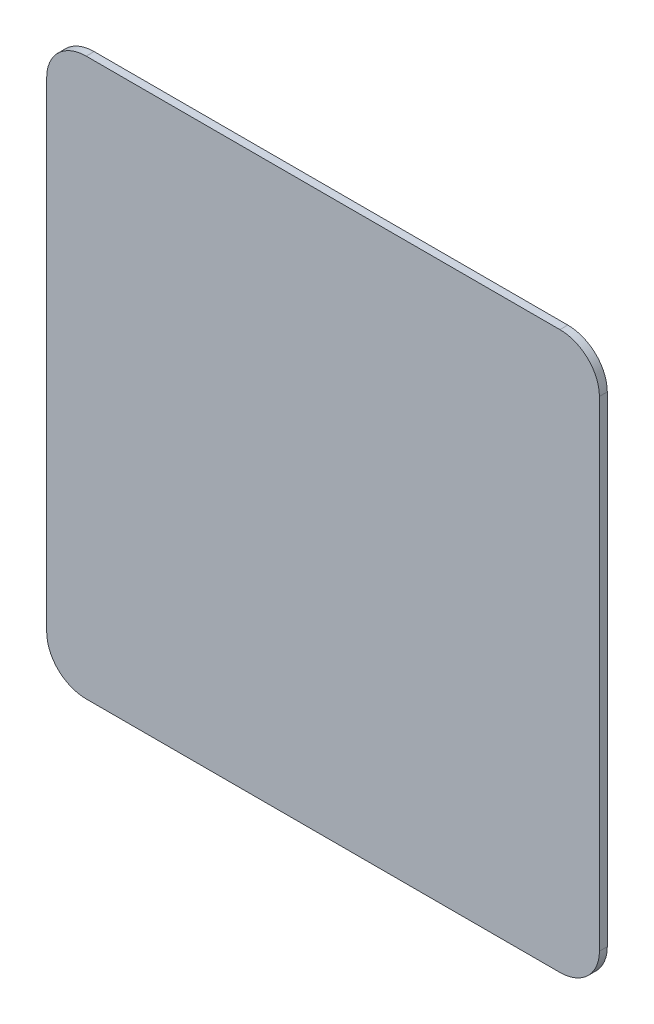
SolidWorks part; units mm, degrees
ref_plane "Front Plane" through (0, 0, 0) normal (0, 0, 1) x (1, 0, 0)
ref_plane "Top Plane" through (0, 0, 0) normal (0, 1, 0) x (1, 0, 0)
ref_plane "Right Plane" through (0, 0, 0) normal (1, 0, 0) x (0, 0, -1)
sketch "Sketch1" plane through (0, 0, 0) normal (0, 0, 1) x (1, 0, 0)
  line L0 (350, -287.1896) -> (350, 321.3437) construction
  line L1 (-300, -335.4858) -> (300, -335.4858) construction
  line L2 (300, 369.64) -> (-300, 369.64) construction
  line L3 (-350, 321.3437) -> (-350, -287.1896) construction
  line L4 (350, -287.1896) -> (350, 321.3437)
  line L5 (-300, -335.4858) -> (300, -335.4858)
  line L6 (300, 369.64) -> (-300, 369.64)
  line L7 (-350, 321.3437) -> (-350, -287.1896)
  ellipse E0 centre (300, 321.3437) end of major axis (350, 321.3437) minor radius 48.2963 (350, 321.3437) -> (300, 369.64) ccw construction
  ellipse E1 centre (300, -287.1896) end of major axis (350, -287.1896) minor radius 48.2963 (300, -335.4858) -> (350, -287.1896) ccw construction
  ellipse E2 centre (-300, 321.3437) end of major axis (-250, 321.3437) minor radius 48.2963 (-300, 369.64) -> (-350, 321.3437) ccw construction
  ellipse E3 centre (-300, -287.1896) end of major axis (-250, -287.1896) minor radius 48.2963 (-350, -287.1896) -> (-300, -335.4858) ccw construction
  ellipse E4 centre (300, 321.3437) end of major axis (350, 321.3437) minor radius 48.2963 (350, 321.3437) -> (300, 369.64) ccw
  ellipse E5 centre (300, -287.1896) end of major axis (350, -287.1896) minor radius 48.2963 (300, -335.4858) -> (350, -287.1896) ccw
  ellipse E6 centre (-300, 321.3437) end of major axis (-250, 321.3437) minor radius 48.2963 (-300, 369.64) -> (-350, 321.3437) ccw
  ellipse E7 centre (-300, -287.1896) end of major axis (-250, -287.1896) minor radius 48.2963 (-350, -287.1896) -> (-300, -335.4858) ccw
extrude "Boss-Extrude1" add sketch "Sketch1" against normal blind 10
